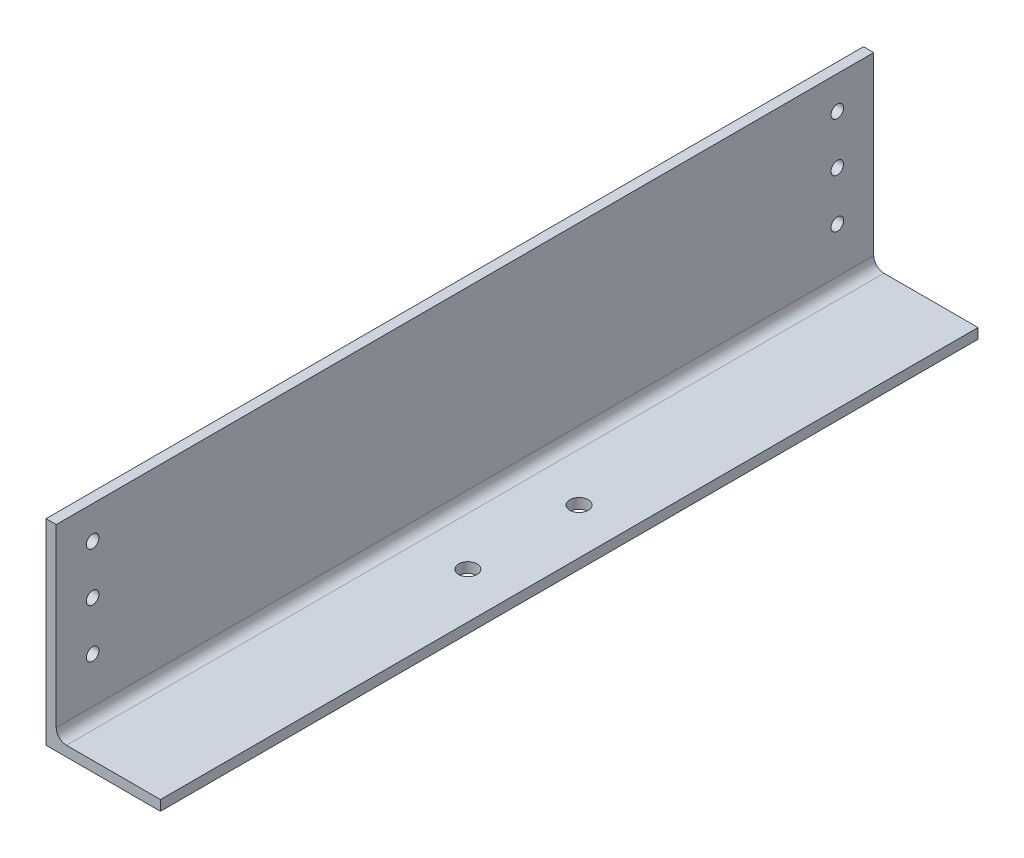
SolidWorks part; units mm, degrees
ref_plane "Front Plane" through (0, 0, 0) normal (0, 0, 1) x (1, 0, 0)
ref_plane "Top Plane" through (0, 0, 0) normal (0, 1, 0) x (1, 0, 0)
ref_plane "Right Plane" through (0, 0, 0) normal (1, 0, 0) x (0, 0, -1)
sketch "sk LS6x3.5x0.312" plane through (0, 0, 0) normal (0, 0, 1) x (1, 0, 0)
  line L0 (-19.3153, -50.8356) -> (-19.3153, 101.5644)
  line L1 (-7.9738, 101.5644) -> (-14.8072, 101.5644) construction
  line L2 (-11.3905, 101.5644) -> (-11.3905, -34.986)
  line L3 (-3.4657, -42.9108) -> (69.5847, -42.9108)
  line L4 (69.5847, -34.986) -> (69.5847, -50.8356) construction
  line L5 (69.5847, -50.8356) -> (-19.3153, -50.8356)
  line L6 (-19.3153, 101.5644) -> (-11.3905, 101.5644)
  line L7 (69.5847, -50.8356) -> (69.5847, -42.9108)
  arc A2 (-3.4657, -42.9108) -> (-11.3905, -34.986) centre (-3.4657, -34.986) cw
  point P10 (0, 0)
  dimension "D2" = 19.3153
  dimension "D3" = 50.8356
  dimension "Radius_1" = 7.9248
  dimension "D1" = 7.9248
  dimension "V_leg" = 152.4
  dimension "H_leg" = 88.9
  dimension "Thickness" = 7.9248
extrude "Boss-Extrude1" add sketch "sk LS6x3.5x0.312" along normal mid plane 635
sketch "Sketch2" plane through (0, 0, 0) normal (1, 0, 0) x (0, 0, -1)
  line L0 (-317.5, 101.5644) -> (317.5, 101.5644) construction
  line B0 (-289.1991, 38.2649) -> (289.1991, 38.2649) construction
  circle B1 centre (-289.1991, 76.1644) radius 4.9022
  circle B2 centre (-289.1991, 38.2649) radius 4.9022
  circle B3 centre (-289.1991, 0.3654) radius 4.9022
  circle B4 centre (289.1991, 76.1644) radius 4.9022
  circle B5 centre (289.1991, 38.2649) radius 4.9022
  circle B6 centre (289.1991, 0.3654) radius 4.9022
  dimension "D1" = 25.4
sketch_block_instance "Block1-1"
sketch_block "Block1"
extrude "Cut-Extrude1" cut sketch "Sketch2" against normal through all
sketch "Sketch3" plane through (0, 0, 0) normal (0, 1, 0) x (1, 0, 0)
  line L0 (69.5847, -317.5) -> (69.5847, 317.5) construction
  circle A0 centre (34.0247, 43.18) radius 7.1437
  circle A1 centre (34.0247, -43.18) radius 7.1437
  dimension "D1" = 14.2875
  dimension "D2" = 14.2875
  dimension "D3" = 35.56
  dimension "D4" = 43.18
  dimension "D5" = 43.18
extrude "Cut-Extrude2" cut sketch "Sketch3" against normal through all
